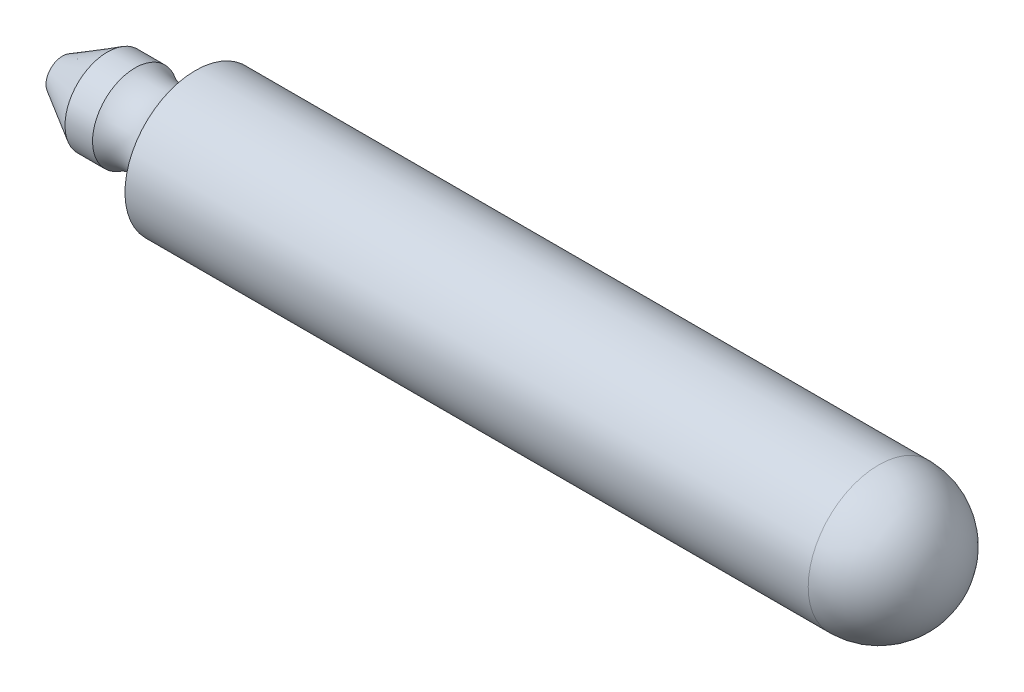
SolidWorks part; units mm, degrees
ref_plane "Front Plane" through (0, 0, 0) normal (0, 0, 1) x (1, 0, 0)
ref_plane "Top Plane" through (0, 0, 0) normal (0, 1, 0) x (1, 0, 0)
ref_plane "Right Plane" through (0, 0, 0) normal (1, 0, 0) x (0, 0, -1)
sketch "Sketch1" plane through (0, 0, 0) normal (0, 0, 1) x (1, 0, 0)
  line L0 (0, 0) -> (-15.748, 0)
  line L1 (-15.748, 0) -> (-15.748, 0.318)
  line L2 (-15.748, 0.318) -> (-14.8802, 0.819)
  line L3 (-14.8802, 0.819) -> (-14.3486, 0.819)
  line L4 (0, 0) -> (0, 1.359) construction
  line L5 (0, 1.359) -> (-13.183, 1.359)
  line L6 (0, 0) -> (1.359, 0)
  arc A0 (-14.3486, 0.819) -> (-13.183, 1.359) centre (-13.9381, 1.461) ccw
  arc A1 (1.359, 0) -> (0, 1.359) centre (0, 0) ccw
  dimension "D7" = 1.524
  dimension "D1" = 15.748
  dimension "D2" = 0.318
  dimension "D3" = 30
  dimension "D4" = 1.359
  dimension "D5" = 0.819
  dimension "D6" = 1.461
  dimension "D8" = 13.183
revolve "Revolve1" add sketch "Sketch1" angle 360 about L0
